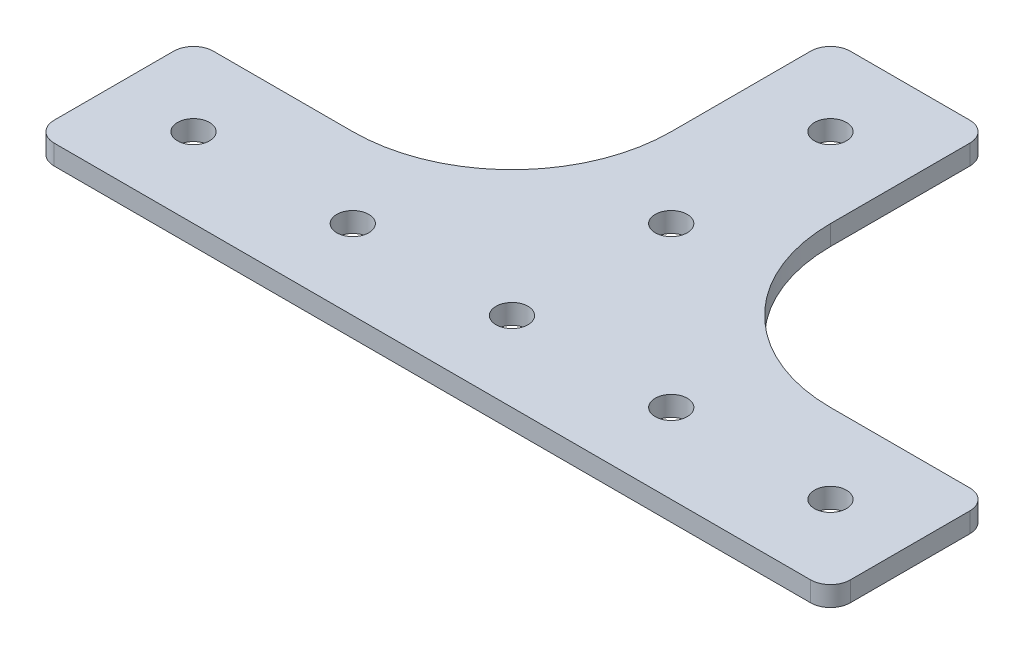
SolidWorks part; units mm, degrees
ref_plane "Front Plane" through (0, 0, 0) normal (0, 0, 1) x (1, 0, 0)
ref_plane "Top Plane" through (0, 0, 0) normal (0, 1, 0) x (1, 0, 0)
ref_plane "Right Plane" through (0, 0, 0) normal (1, 0, 0) x (0, 0, -1)
sketch "Sketch1" plane through (0, 0, 0) normal (0, 1, 0) x (1, 0, 0)
  line L0 (-60.325, 0) -> (60.325, 0)
  line L1 (63.5, 3.175) -> (63.5, 22.225)
  line L2 (60.325, 25.4) -> (38.1, 25.4)
  line L3 (12.7, 50.8) -> (12.7, 73.025)
  line L4 (9.525, 76.2) -> (-9.525, 76.2)
  line L5 (-12.7, 73.025) -> (-12.7, 50.8)
  line L6 (-38.1, 25.4) -> (-60.325, 25.4)
  line L7 (-63.5, 22.225) -> (-63.5, 3.175)
  arc A0 (38.1, 25.4) -> (12.7, 50.8) centre (38.1, 50.8) cw
  arc A1 (-12.7, 50.8) -> (-38.1, 25.4) centre (-38.1, 50.8) cw
  arc A2 (-60.325, 0) -> (-63.5, 3.175) centre (-60.325, 3.175) cw
  arc A3 (-60.325, 25.4) -> (-63.5, 22.225) centre (-60.325, 22.225) ccw
  arc A4 (60.325, 0) -> (63.5, 3.175) centre (60.325, 3.175) ccw
  arc A5 (63.5, 22.225) -> (60.325, 25.4) centre (60.325, 22.225) ccw
  arc A6 (12.7, 73.025) -> (9.525, 76.2) centre (9.525, 73.025) ccw
  arc A7 (-9.525, 76.2) -> (-12.7, 73.025) centre (-9.525, 73.025) ccw
  point P13 (-12.7, 25.4)
  point P16 (-63.5, 0)
  point P21 (63.5, 0)
  point P26 (12.7, 76.2)
  point P29 (-12.7, 76.2)
  dimension "D4" = 25.4
  dimension "D5" = 3.175
  dimension "D1" = 127
  dimension "D2" = 25.4
  dimension "D3" = 50.8
extrude "Boss-Extrude1" add sketch "Sketch1" along normal blind 3.175
hole_wizard "#7 (0.201) Diameter Hole1" positions "Sketch4" profile "Sketch3" hole size "#7" standard "ANSI Inch"
sketch "Sketch4" plane through (0, 3.175, 0) normal (0, 1, 0) x (1, 0, 0)
  line L1 (-60.325, 0) -> (60.325, 0) construction
  point P0 (-50.8, 12.7)
  point P2 (-25.4, 12.7)
  point P4 (0, 12.7)
  point P6 (25.4, 12.7)
  point P8 (50.8, 12.7)
  point P10 (0, 38.1)
  point P12 (0, 63.5)
  dimension "D1" = 12.7
  dimension "D2" = 25.4
  dimension "D3" = 25.4
  dimension "D4" = 25.4
  dimension "D5" = 25.4
  dimension "D6" = 25.4
  dimension "D7" = 25.4
sketch "Sketch3" plane through (-50.8, 3.175, -12.7) normal (1, 0, 0) x (0, 0, 1)
  line L0 (0, 0) -> (0, 3.175)
  line L1 (0, 3.175) -> (2.5527, 3.175)
  line L2 (2.5527, 3.175) -> (2.5527, 0)
  line L5 (2.5527, 0) -> (0, 0)
  line L11 (0, -6.35) -> (0, 107.95) construction
  dimension "Thru Hole Dia." = 5.1054
  dimension "Thru Hole Depth" = 3.175
